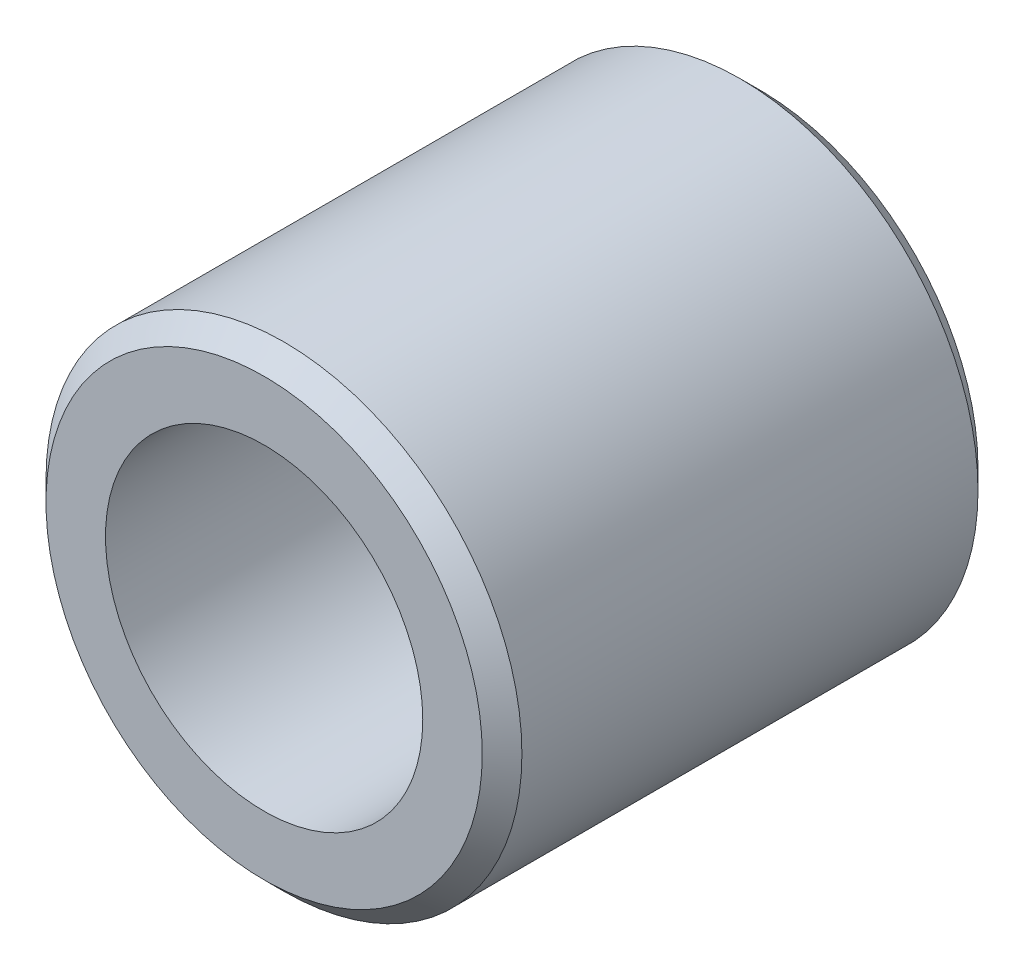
SolidWorks part; units mm, degrees
ref_plane "Plan de face" through (0, 0, 0) normal (0, 0, 1) x (1, 0, 0)
ref_plane "Plan de dessus" through (0, 0, 0) normal (0, 1, 0) x (1, 0, 0)
ref_plane "Plan de droite" through (0, 0, 0) normal (1, 0, 0) x (0, 0, -1)
sketch "Esquisse1" plane through (0, 0, 0) normal (0, 0, 1) x (1, 0, 0)
  circle A0 centre (0, 0) radius 6
  circle A1 centre (0, 0) radius 4
  dimension "D1" = 12
  dimension "D2" = 8
extrude "Extrusion1" add sketch "Esquisse1" along normal blind 12.5
chamfer "Chanfrein1" distance 0.5 angle 45 2 edges at (6, 0, 0) (6, 0, 12.5)
